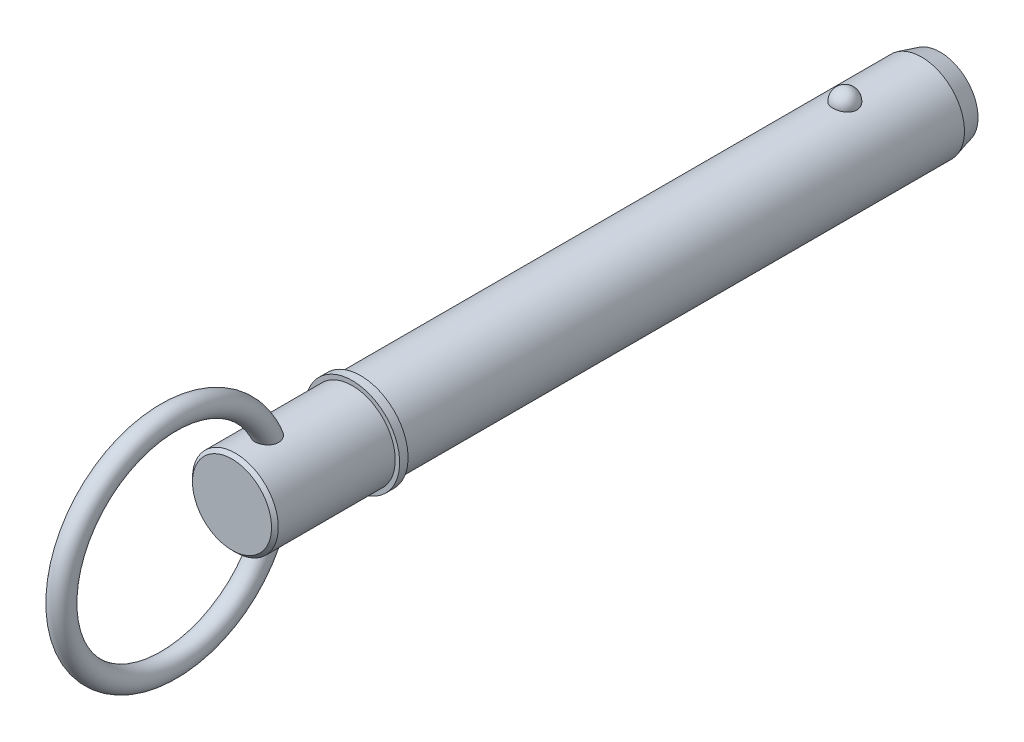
SolidWorks part; units mm, degrees
ref_plane "Front Plane" through (0, 0, 0) normal (0, 0, 1) x (1, 0, 0)
ref_plane "Top Plane" through (0, 0, 0) normal (0, 1, 0) x (1, 0, 0)
ref_plane "Right Plane" through (0, 0, 0) normal (1, 0, 0) x (0, 0, -1)
sketch "Sketch2" plane through (0, 0, 0) normal (0, 0, 1) x (1, 0, 0)
  circle A0 centre (0, 0) radius 12.7
  point P3 (0, 12.7)
  dimension "D1" = 25.4
extrude "Boss-Extrude1" add sketch "Sketch2" along normal blind 139.7
sketch "Sketch3" plane through (0, 0, 0) normal (0, 0, -1) x (-1, 0, 0)
  circle A0 centre (0, 0) radius 12.7
  dimension "D1" = 25.4
extrude "Boss-Extrude2" add sketch "Sketch3" along normal blind 31.75
chamfer "Chamfer1" distance 5.5 angle 15 1 edges at (-12.7, 0, -31.75)
sketch "Sketch18" plane through (0, 0, 0) normal (1, 0, 0) x (0, 0, -1)
  line L0 (26.25, 12.7) -> (-139.7, 12.7) construction
  line L1 (3.56, 16.26) -> (3.56, 9.14)
  line L2 (-139.7, -12.7) -> (26.25, -12.7) construction
  arc A0 (3.56, 16.26) -> (3.56, 9.14) centre (3.56, 12.7) ccw
  point P4 (0, 12.7)
  dimension "D1" = 28.96
revolve "Revolve1" add sketch "Sketch18" angle 360 about L1
sketch "Sketch19" plane through (0, 0, 0) normal (1, 0, 0) x (0, 0, -1)
  line L0 (-33.7288, 0) -> (-46.4542, 0) construction
sketch "Sketch20" plane through (0, 0, 0) normal (1, 0, 0) x (0, 0, -1)
  line L0 (-139.7, 0) -> (-139.7, 14)
  line L1 (-139.7, 12.7) -> (-139.7, -12.7) construction
  line L2 (-139.7, 14) -> (-142.2, 14)
  line L3 (-142.2, 14) -> (-142.2, 0)
  line L4 (-33.7288, 0) -> (-46.4542, 0) construction
  line L5 (-142.2, 0) -> (-139.7, 0)
  dimension "D1" = 14
  dimension "D2" = 2.5
revolve "Revolve2" add sketch "Sketch20" angle 360 about L0
sketch "Sketch21" plane through (0, 0, 139.7) normal (0, 0, -1) x (-1, 0, 0)
  circle A0 centre (0, 0) radius 12.7
  dimension "D1" = 25.4
extrude "Boss-Extrude3" add sketch "Sketch21" against normal blind 38.1
chamfer "Chamfer2" distance 1 angle 45 1 edges at (-12.7, 0, 177.8)
sketch "Sketch23" plane through (0, 0, 0) normal (1, 0, 0) x (0, 0, -1)
  line L0 (-177.8, 11.7) -> (-177.8, -11.7) construction
  circle A0 centre (-196.55, 0) radius 31.75
  point P2 (-164.8, 0)
  dimension "D1" = 63.5
  dimension "D2" = 13
sketch "Sketch24" plane through (0, 0, 0) normal (0, 1, 0) x (1, 0, 0)
  circle A0 centre (0, -164.8) radius 3.25
  dimension "D1" = 6.5
sweep "Sweep1" add profiles "Sketch24" path "Sketch23"
